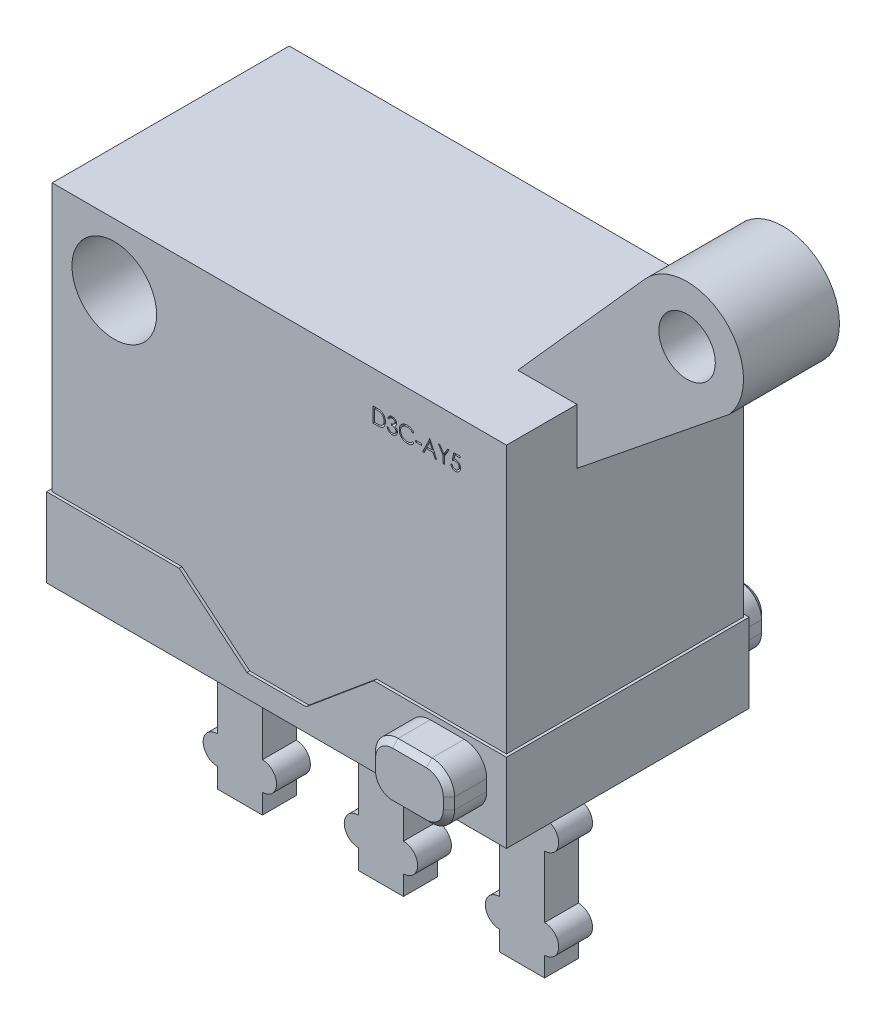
SolidWorks part; units mm, degrees
ref_plane "Alzado" through (0, 0, 0) normal (0, 0, 1) x (1, 0, 0)
ref_plane "Planta" through (0, 0, 0) normal (0, 1, 0) x (1, 0, 0)
ref_plane "Vista lateral" through (0, 0, 0) normal (1, 0, 0) x (0, 0, -1)
sketch "Sketch1" plane through (0, 0, 0) normal (0, 0, 1) x (1, 0, 0)
  line L0 (7, 6.14) -> (9.2539, 8.6658)
  line L1 (0, 0) -> (0.63, 0)
  line L2 (0, 0) -> (0, 6.14)
  line L3 (0, 6.14) -> (7, 6.14)
  line L4 (8.05, 0) -> (8.05, 5.1585)
  line L5 (10.7461, 7.3342) -> (8.05, 5.1585)
  line L7 (9.2539, 8.6658) -> (10.7461, 7.3342) construction
  line L8 (10, 8) -> (7.5222, 5.6365) construction
  line L10 (4.025, 0) -> (4.025, 2.0871) construction
  line L11 (2.23, 0.35) -> (2.33, 0)
  line L12 (7.42, 0) -> (7.42, 0.35)
  line L13 (7.42, 0.35) -> (5.82, 0.35)
  line L14 (7.42, 0) -> (8.05, 0)
  line L15 (5.82, 0.35) -> (5.72, 0)
  line L16 (0.63, 0.35) -> (2.23, 0.35)
  line L17 (0.63, 0) -> (0.63, 0.35)
  line L18 (2.33, 0) -> (5.72, 0)
  arc A0 (9.2539, 8.6658) -> (10.7461, 7.3342) centre (10, 8) cw
  dimension "D5" = 9
  dimension "D8" = 7
  dimension "D4" = 1
  dimension "D1" = 6.14
  dimension "D2" = 8.05
  dimension "D3" = 11
  dimension "D7" = 5.1585
  dimension "D13" = 0.63
  dimension "D14" = 0.35
  dimension "D15" = 1.6
  dimension "D16" = 1.7
  dimension "D17" = 0.63
extrude "Extrude1" add sketch "Sketch1" against normal blind 4.2
sketch "Sketch2" plane through (0, 0, 0) normal (0, 0, 1) x (1, 0, 0)
  line L0 (0, 0) -> (0, 1.4)
  line L1 (0, 6.14) -> (0, 0) construction
  line L2 (0, 1.4) -> (2.3, 1.4)
  line L3 (2.3, 1.4) -> (3.5, 0.4)
  line L4 (3.5, 0.4) -> (4.55, 0.4)
  line L5 (4.025, 0) -> (4.025, 3.668) construction
  line L6 (0, 0) -> (0.63, 0) construction
  line L7 (5.75, 1.4) -> (4.55, 0.4)
  line L8 (8.05, 1.4) -> (5.75, 1.4)
  line L9 (8.05, 0) -> (8.05, 1.4)
  line L10 (8.05, 0) -> (0, 0)
  line L11 (0, 6.14) -> (0, 0) construction
  line L12 (8.05, 0) -> (8.05, 5.1585) construction
  dimension "D1" = 1.4
  dimension "D2" = 2.3
  dimension "D3" = 3.5
  dimension "D4" = 0.4
extrude "Extrude2" add sketch "Sketch2" along normal blind 0.05
sketch "Sketch3" plane through (0, 0, -4.2) normal (0, 0, -1) x (-1, 0, 0)
  line L8 (-8.05, 0) -> (0, 0)
  line L9 (-8.05, 1.4) -> (-8.05, 0)
  line L10 (-5.75, 1.4) -> (-8.05, 1.4)
  line L11 (-4.55, 0.4) -> (-5.75, 1.4)
  line L12 (-3.5, 0.4) -> (-4.55, 0.4)
  line L13 (-2.3, 1.4) -> (-3.5, 0.4)
  line L14 (0, 1.4) -> (-2.3, 1.4)
  line L15 (0, 0) -> (0, 1.4)
  line L16 (-8.05, 0) -> (0, 0)
  line L17 (-8.05, 1.4) -> (-8.05, 0)
  line L18 (-5.75, 1.4) -> (-8.05, 1.4)
  line L19 (-4.55, 0.4) -> (-5.75, 1.4)
  line L20 (-3.5, 0.4) -> (-4.55, 0.4)
  line L21 (-2.3, 1.4) -> (-3.5, 0.4)
  line L22 (0, 1.4) -> (-2.3, 1.4)
  line L23 (0, 0) -> (0, 1.4)
  dimension "D1" = 0
extrude "Extrude3" add sketch "Sketch3" along normal blind 0.05
sketch "Sketch5" plane through (0, 0, 0) normal (-1, 0, 0) x (0, 0, 1)
  line L1 (-4.25, 1.4) -> (0.05, 1.4)
  line L2 (-4.25, 1.4) -> (-4.25, 0)
  line L3 (-4.25, 0) -> (0.05, 0)
  line L4 (0.05, 1.4) -> (0.05, 0)
extrude "Extrude4" add sketch "Sketch5" along normal blind 0.05
sketch "Sketch6" plane through (8.05, 0, 0) normal (1, 0, 0) x (0, 0, -1)
  line L1 (-0.05, 1.4) -> (4.25, 1.4)
  line L2 (-0.05, 1.4) -> (-0.05, 0)
  line L3 (-0.05, 0) -> (4.25, 0)
  line L4 (4.25, 1.4) -> (4.25, 0)
extrude "Extrude5" add sketch "Sketch6" along normal blind 0.05
sketch "Sketch10" plane through (0, 0, 0) normal (0, -1, 0) x (1, 0, 0)
  line L0 (4.025, 0.05) -> (4.025, -0.7322) construction
  line L1 (0.875, -1.8) -> (2.175, -1.8)
  line L2 (0.875, -1.8) -> (0.875, -2.4)
  line L3 (0.875, -2.4) -> (2.175, -2.4)
  line L4 (2.175, -1.8) -> (2.175, -2.4)
  line L5 (4.675, -1.8) -> (3.375, -1.8)
  line L6 (4.675, -1.8) -> (4.675, -2.4)
  line L7 (4.675, -2.4) -> (3.375, -2.4)
  line L8 (3.375, -1.8) -> (3.375, -2.4)
  line L9 (5.875, -1.8) -> (7.175, -1.8)
  line L10 (5.875, -1.8) -> (5.875, -2.4)
  line L11 (5.875, -2.4) -> (7.175, -2.4)
  line L12 (7.175, -1.8) -> (7.175, -2.4)
  line L13 (-0.05, 0.05) -> (8.1, 0.05) construction
  line L14 (-0.05, -2.1) -> (2.8026, -2.1) construction
  line L15 (-0.05, -4.25) -> (-0.05, 0.05) construction
  dimension "D1" = 1.3
  dimension "D2" = 1.3
  dimension "D3" = 1.3
  dimension "D4" = 0.6
  dimension "D5" = 6.3
extrude "Extrude7" add sketch "Sketch10" along normal blind 3.5
sketch "Sketch11" plane through (0, 0, -1.8) normal (0, 0, 1) x (1, 0, 0)
  line L0 (4.425, 0) -> (4.425, -1.05)
  line L1 (-0.05, 0) -> (8.1, 0) construction
  line L2 (4.425, -2.65) -> (4.425, -1.55)
  line L3 (4.425, -3.15) -> (4.425, -3.5)
  line L4 (4.675, -3.5) -> (3.375, -3.5) construction
  line L5 (4.425, -3.5) -> (4.675, -3.5)
  line L6 (4.675, -3.5) -> (4.675, 0)
  line L7 (4.675, 0) -> (4.425, 0)
  line L8 (4.025, 0) -> (4.025, -2.961) construction
  line L9 (3.375, 0) -> (3.625, 0)
  line L10 (3.375, -3.5) -> (3.375, 0)
  line L11 (3.625, -3.5) -> (3.375, -3.5)
  line L12 (3.625, -3.15) -> (3.625, -3.5)
  line L13 (3.625, -2.65) -> (3.625, -1.55)
  line L14 (3.625, 0) -> (3.625, -1.05)
  line L15 (2.775, -0.5696) -> (2.775, -2.65) construction
  line L16 (2.175, -3.5) -> (2.175, 0) construction
  line L17 (5.275, -0.5696) -> (5.275, -2.7514) construction
  line L18 (5.875, -3.5) -> (5.875, 0) construction
  line L19 (1.925, 0) -> (1.925, -1.05)
  line L20 (1.925, -2.65) -> (1.925, -1.55)
  line L21 (1.925, -3.15) -> (1.925, -3.5)
  line L22 (1.925, -3.5) -> (2.175, -3.5)
  line L23 (2.175, -3.5) -> (2.175, 0)
  line L24 (2.175, 0) -> (1.925, 0)
  line L25 (0.875, 0) -> (1.125, 0)
  line L26 (0.875, -3.5) -> (0.875, 0)
  line L27 (1.125, -3.5) -> (0.875, -3.5)
  line L28 (1.125, -3.15) -> (1.125, -3.5)
  line L29 (1.125, -2.65) -> (1.125, -1.55)
  line L30 (1.125, 0) -> (1.125, -1.05)
  line L31 (6.925, 0) -> (6.925, -1.05)
  line L32 (6.925, -2.65) -> (6.925, -1.55)
  line L33 (6.925, -3.15) -> (6.925, -3.5)
  line L34 (6.925, -3.5) -> (7.175, -3.5)
  line L35 (7.175, -3.5) -> (7.175, 0)
  line L36 (7.175, 0) -> (6.925, 0)
  line L37 (5.875, 0) -> (6.125, 0)
  line L38 (5.875, -3.5) -> (5.875, 0)
  line L39 (6.125, -3.5) -> (5.875, -3.5)
  line L40 (6.125, -3.15) -> (6.125, -3.5)
  line L41 (6.125, -2.65) -> (6.125, -1.55)
  line L42 (6.125, 0) -> (6.125, -1.05)
  arc A0 (4.425, -1.05) -> (4.425, -1.55) centre (4.425, -1.3) cw
  arc A1 (4.425, -2.65) -> (4.425, -3.15) centre (4.425, -2.9) cw
  arc A2 (3.625, -2.65) -> (3.625, -3.15) centre (3.625, -2.9) ccw
  arc A3 (3.625, -1.05) -> (3.625, -1.55) centre (3.625, -1.3) ccw
  arc A4 (1.925, -1.05) -> (1.925, -1.55) centre (1.925, -1.3) cw
  arc A5 (1.925, -2.65) -> (1.925, -3.15) centre (1.925, -2.9) cw
  arc A6 (1.125, -2.65) -> (1.125, -3.15) centre (1.125, -2.9) ccw
  arc A7 (1.125, -1.05) -> (1.125, -1.55) centre (1.125, -1.3) ccw
  arc A8 (6.925, -1.05) -> (6.925, -1.55) centre (6.925, -1.3) cw
  arc A9 (6.925, -2.65) -> (6.925, -3.15) centre (6.925, -2.9) cw
  arc A10 (6.125, -2.65) -> (6.125, -3.15) centre (6.125, -2.9) ccw
  arc A11 (6.125, -1.05) -> (6.125, -1.55) centre (6.125, -1.3) ccw
  dimension "D2" = 0.6
  dimension "D3" = 2.2
  dimension "D1" = 0.8
extrude "Cut-Extrude3" cut sketch "Sketch11" against normal through all contours A7 L30 L25 L26 | A7 L26 A6 L29 | A6 L26 L27 L28 | L19 A4 L23 L24 | L20 A5 L23 A4 | L23 A5 L21 L22 | A3 L14 M1 M2 | A3 L10 A2 L13 | A2 L12 M2 M3 | L0 A0 L6 M1 | L2 A1 L6 A0 | A1 L3 M4 M3 | A11 L42 L37 L38 | A11 L38 A10 L41 | A10 L38 L39 L40 | L31 A8 L35 L36 | L32 A9 L35 A8 | L35 A9 L33 L34
sketch "Sketch12" plane through (5.2114, -0.1939, 0) normal (0, 0, 1) x (1, 0, 0)
  text T0 "D3C-AY5" font "Century Gothic" height in points 1
extrude "Cut-Extrude4" cut sketch "Sketch12" against normal blind 0.1
sketch "Sketch14" plane through (0, 0, 0) normal (0, 0, 1) x (1, 0, 0)
  line L0 (0, 6.14) -> (0, 1.4) construction
  line L1 (7, 6.14) -> (0, 6.14) construction
  circle A0 centre (1.1, 5.04) radius 0.75
  dimension "D1" = 1.5
  dimension "D2" = 1.1
  dimension "D3" = 1.1
extrude "Cut-Extrude5" cut sketch "Sketch14" against normal through all
sketch "Sketch15" plane through (2.1184, -2.8312, -1.8) normal (0, 0, 1) x (1, 0, 0)
  line L0 (4.0066, -0.3188) -> (4.0066, -0.6688)
  line L1 (5.0566, -0.6688) -> (3.7566, -0.6688) construction
  line L2 (3.7566, -0.6688) -> (4.0066, -0.6688)
  line L12 (-0.1934, 2.8312) -> (-0.1934, 1.7812)
  line L13 (-0.1934, 0.1812) -> (-0.1934, 1.2812)
  line L14 (-0.1934, -0.3188) -> (-0.1934, -0.6688)
  line L15 (-0.1934, -0.6688) -> (0.0566, -0.6688)
  line L16 (0.0566, -0.6688) -> (0.0566, 2.8312)
  line L17 (0.0566, 2.8312) -> (-0.1934, 2.8312)
  line L18 (-1.2434, 2.8312) -> (-0.9934, 2.8312)
  line L19 (-1.2434, -0.6688) -> (-1.2434, 2.8312)
  line L20 (-0.9934, -0.6688) -> (-1.2434, -0.6688)
  line L21 (-0.9934, -0.3188) -> (-0.9934, -0.6688)
  line L22 (-0.9934, 0.1812) -> (-0.9934, 1.2812)
  line L23 (-0.9934, 2.8312) -> (-0.9934, 1.7812)
  line L24 (4.8066, 2.8312) -> (4.8066, 1.7812)
  line L25 (4.8066, 0.1812) -> (4.8066, 1.2812)
  line L26 (4.8066, -0.3188) -> (4.8066, -0.6688)
  line L27 (4.8066, -0.6688) -> (5.0566, -0.6688)
  line L28 (5.0566, -0.6688) -> (5.0566, 2.8312)
  line L29 (5.0566, 2.8312) -> (4.8066, 2.8312)
  line L30 (3.7566, 2.8312) -> (4.0066, 2.8312)
  line L31 (3.7566, -0.6688) -> (3.7566, 2.8312)
  line L34 (4.0066, 0.1812) -> (4.0066, 1.2812)
  line L35 (4.0066, 2.8312) -> (4.0066, 1.7812)
  arc A4 (-0.1934, 1.7812) -> (-0.1934, 1.2812) centre (-0.1934, 1.5312) cw
  arc A5 (-0.1934, 0.1812) -> (-0.1934, -0.3188) centre (-0.1934, -0.0688) cw
  arc A6 (-0.9934, 0.1812) -> (-0.9934, -0.3188) centre (-0.9934, -0.0688) ccw
  arc A7 (-0.9934, 1.7812) -> (-0.9934, 1.2812) centre (-0.9934, 1.5312) ccw
  arc A8 (4.8066, 1.7812) -> (4.8066, 1.2812) centre (4.8066, 1.5312) cw
  arc A9 (4.8066, 0.1812) -> (4.8066, -0.3188) centre (4.8066, -0.0688) cw
  arc A10 (4.0066, 0.1812) -> (4.0066, -0.3188) centre (4.0066, -0.0688) ccw
  arc A11 (4.0066, 1.7812) -> (4.0066, 1.2812) centre (4.0066, 1.5312) ccw
extrude "Cut-Extrude7" cut sketch "Sketch15" against normal blind 10 contours A10 L31 L2 L0 | A11 L31 A10 L34 | A11 L35 L30 L31 | L24 A8 L28 L29 | L25 A9 L28 A8 | L28 A9 L26 L27 | A6 L21 M2 M3 | A7 L19 A6 L22 | A7 L23 M1 M2 | L12 A4 L16 M1 | L13 A5 L16 A4 | A5 L14 M4 M3
sketch "Sketch16" plane through (0, 0, 0) normal (0, 0, 1) x (1, 0, 0)
  circle A0 centre (10, 8) radius 0.5
  dimension "D1" = 1
extrude "Cut-Extrude8" cut sketch "Sketch16" against normal through all
sketch "Sketch17" plane through (0, 0, 0.05) normal (0, 0, 1) x (1, 0, 0)
  line L0 (8.1, 1.4) -> (8.1, 0) construction
  line L1 (6.75, 1.3) -> (7.35, 1.3)
  line L2 (6.35, 0.9) -> (6.35, 0.7)
  line L3 (6.75, 0.3) -> (7.35, 0.3)
  line L4 (7.75, 0.9) -> (7.75, 0.7)
  line L5 (8.05, 1.4) -> (5.75, 1.4) construction
  arc A0 (7.35, 0.3) -> (7.75, 0.7) centre (7.35, 0.7) ccw
  arc A1 (7.35, 1.3) -> (7.75, 0.9) centre (7.35, 0.9) cw
  arc A2 (6.35, 0.7) -> (6.75, 0.3) centre (6.75, 0.7) ccw
  arc A3 (6.75, 1.3) -> (6.35, 0.9) centre (6.75, 0.9) ccw
  point P10 (7.75, 0.3)
  point P13 (7.75, 1.3)
  point P16 (6.35, 0.3)
  dimension "D5" = 0.4
  dimension "D1" = 0.35
  dimension "D2" = 1.4
  dimension "D3" = 1
  dimension "D4" = 0.1
extrude "Extrude8" add sketch "Sketch17" along normal blind 0.67
sketch "Sketch18" plane through (0, 0, -4.25) normal (0, 0, -1) x (-1, 0, 0)
  line L4 (-7.75, 0.9) -> (-7.75, 0.7)
  line L5 (-6.75, 1.3) -> (-7.35, 1.3)
  line L6 (-6.35, 0.7) -> (-6.35, 0.9)
  line L7 (-7.35, 0.3) -> (-6.75, 0.3)
  line L8 (-7.75, 0.9) -> (-7.75, 0.7)
  line L9 (-6.75, 1.3) -> (-7.35, 1.3)
  line L10 (-6.35, 0.7) -> (-6.35, 0.9)
  line L11 (-7.35, 0.3) -> (-6.75, 0.3)
  arc A4 (-7.75, 0.7) -> (-7.35, 0.3) centre (-7.35, 0.7) ccw
  arc A5 (-7.35, 1.3) -> (-7.75, 0.9) centre (-7.35, 0.9) ccw
  arc A6 (-6.35, 0.9) -> (-6.75, 1.3) centre (-6.75, 0.9) ccw
  arc A7 (-6.75, 0.3) -> (-6.35, 0.7) centre (-6.75, 0.7) ccw
  arc A8 (-7.75, 0.7) -> (-7.35, 0.3) centre (-7.35, 0.7) ccw
  arc A9 (-7.35, 1.3) -> (-7.75, 0.9) centre (-7.35, 0.9) ccw
  arc A10 (-6.35, 0.9) -> (-6.75, 1.3) centre (-6.75, 0.9) ccw
  arc A11 (-6.75, 0.3) -> (-6.35, 0.7) centre (-6.75, 0.7) ccw
  dimension "D1" = 0
extrude "Extrude9" add sketch "Sketch18" along normal blind 0.67
chamfer "Chamfer1" distance 0.1 angle 45 16 edges at (7.75, 0.8, -4.92) (7.6328, 1.1828, -4.92) (7.05, 1.3, -4.92) (6.4672, 1.1828, -4.92) (6.35, 0.8, -4.92) (6.4672, 0.4172, -4.92) (7.05, 0.3, -4.92) (7.6328, 0.4172, -4.92) (7.05, 0.3, 0.72) (6.4672, 0.4172, 0.72) (6.35, 0.8, 0.72) (6.4672, 1.1828, 0.72) (7.05, 1.3, 0.72) (7.6328, 1.1828, 0.72) (7.75, 0.8, 0.72) (7.6328, 0.4172, 0.72)
sketch "Sketch19" plane through (0, 0, -4.2) normal (0, 0, -1) x (-1, 0, 0)
  line L0 (-9.2539, 8.6658) -> (-7, 6.14) construction
  line L1 (-8.05, 5.1585) -> (-10.7461, 7.3342) construction
  line L2 (-9.2539, 8.6658) -> (-7, 6.14)
  line L3 (-8.05, 5.1585) -> (-10.4932, 7.1301)
  line L4 (-8.05, 6.14) -> (-8.05, 5.1585)
  line L6 (-8.05, 6.14) -> (-7, 6.14)
  line L7 (-8.05, 1.4) -> (-8.05, 5.1585) construction
  arc A0 (-9.2539, 8.6658) -> (-10.4932, 7.1301) centre (-10, 8) ccw
extrude "Cut-Extrude9" cut sketch "Sketch19" against normal blind 1.25
sketch "Sketch20" plane through (0, 0, 0) normal (0, 0, 1) x (1, 0, 0)
  line L4 (9.2539, 8.6658) -> (7, 6.14)
  line L5 (7, 6.14) -> (8.05, 6.14)
  line L6 (8.05, 6.14) -> (8.05, 5.1585)
  line L7 (8.05, 5.1585) -> (10.4932, 7.1301)
  line L8 (9.2539, 8.6658) -> (7, 6.14)
  line L9 (7, 6.14) -> (8.05, 6.14)
  line L10 (8.05, 6.14) -> (8.05, 5.1585)
  line L11 (8.05, 5.1585) -> (10.4932, 7.1301)
  arc A1 (10.4932, 7.1301) -> (9.2539, 8.6658) centre (10, 8) ccw
  arc A2 (10.4932, 7.1301) -> (9.2539, 8.6658) centre (10, 8) ccw
  dimension "D1" = 0
extrude "Cut-Extrude10" cut sketch "Sketch20" against normal blind 1.25
